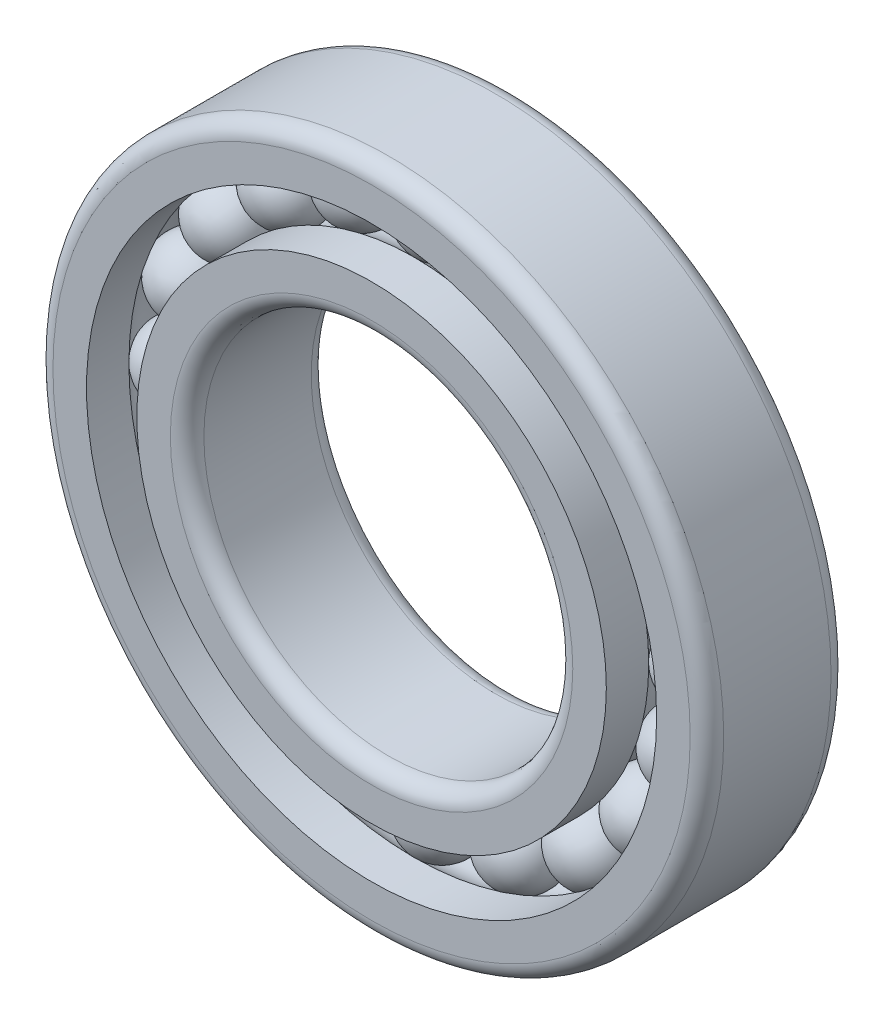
SolidWorks part; units mm, degrees
ref_plane "Front Plane" through (0, 0, 0) normal (0, 0, 1) x (1, 0, 0)
ref_plane "Top Plane" through (0, 0, 0) normal (0, 1, 0) x (1, 0, 0)
ref_plane "Right Plane" through (0, 0, 0) normal (1, 0, 0) x (0, 0, -1)
sketch "BaseSke" plane through (0, 0, 0) normal (1, 0, 0) x (0, 0, -1)
  line L0 (-47.2296, 0) -> (24.6132, 0) construction
  line L1 (-47.2296, 38.75) -> (24.6132, 38.75) construction
  line L2 (0, 129.5214) -> (0, -86.3012) construction
  line L3 (0, 44.375) -> (0, 33.125)
  line L4 (-10.5, 50) -> (10.5, 50) construction
  line L5 (-10.5, 27.5) -> (10.5, 27.5) construction
  arc A0 (0, 44.375) -> (0, 33.125) centre (0, 38.75) ccw
  dimension "Ball_diameter" = 11.25
  dimension "D1" = 38.75
  dimension "Bearing_Thickness" = 21
  dimension "Bearing_Outside_Diameter" = 100
  dimension "Bearing_Inside_Diameter" = 55
revolve "Ball" add sketch "BaseSke" angle 360 about L3
sketch "OuterRaceSke" plane through (0, 0, 0) normal (1, 0, 0) x (0, 0, -1)
  line L0 (0, 0) -> (0, 87.5396) construction
  line L1 (-10.5, 50) -> (10.5, 50)
  line L2 (-10.5, 50) -> (-10.5, 42.5)
  line L3 (-10.5, 42.5) -> (-4.1792, 42.5)
  line L4 (10.5, 50) -> (10.5, 42.5)
  line L5 (-50.3916, 0) -> (55.2197, 0) construction
  line L6 (-47.2296, 38.75) -> (24.6132, 38.75) construction
  line L7 (4.1792, 42.5) -> (10.5, 42.5)
  arc A0 (4.1792, 42.5) -> (-4.1792, 42.5) centre (0, 38.75) ccw
  dimension "D4" = 11.23
  dimension "D2" = 85
revolve "OuterRace" add sketch "OuterRaceSke" angle 360 about L5
sketch "InnerRaceSke" plane through (0, 0, 0) normal (1, 0, 0) x (0, 0, -1)
  line L0 (-70.8626, 0) -> (113.5527, 0) construction
  line L1 (0, 58.441) -> (0, -70.8113) construction
  line L2 (-10.5, 27.5) -> (10.5, 27.5)
  line L3 (-10.5, 27.5) -> (-10.5, 35)
  line L4 (-10.5, 35) -> (-4.1792, 35)
  line L5 (10.5, 27.5) -> (10.5, 35)
  line L6 (0, 129.5214) -> (0, -86.3012) construction
  line L7 (4.1792, 35) -> (10.5, 35)
  arc A0 (-4.1792, 35) -> (4.1792, 35) centre (0, 38.75) ccw
  arc A1 (0, 44.375) -> (0, 33.125) centre (0, 38.75) ccw construction
  dimension "D2" = 11.23
  dimension "D1" = 70
revolve "InnerRace" add sketch "InnerRaceSke" angle 360 about L0
fillet "Fillet1" radius 2.5 4 edges at (27.5, 0, -10.5) (27.5, 0, 10.5) (50, 0, -10.5) (50, 0, 10.5)
sketch "ShieldedSke" plane through (0, 0, 0) normal (1, 0, 0) x (0, 0, -1)
  line L1 (-9.25, 42.5) -> (-7, 42.5)
  line L2 (-10.5, 41.25) -> (-10.5, 36.25)
  line L3 (-9.25, 35) -> (-7, 35)
  line L4 (-7, 42.5) -> (-7, 35)
  arc A0 (-9.25, 42.5) -> (-10.5, 41.25) centre (-9.25, 41.25) ccw
  arc A1 (-10.5, 36.25) -> (-9.25, 35) centre (-9.25, 36.25) ccw
  point P12 (-10.5, 42.5)
  point P13 (-10.5, 35)
  dimension "D1" = 1.25
  dimension "D2" = 7
revolve "Shielded" [suppressed] add sketch "ShieldedSke" angle 360 about L0
mirror "DoubleShielded" [suppressed] about plane through (0, 0, 0) normal (0, 0, 1)
sketch "SealedSke" plane through (0, 0, 0) normal (1, 0, 0) x (0, 0, -1)
  line L0 (-34.5153, 0) -> (39.09, 0) construction
  line L1 (-28.4, 35) -> (-8.4, 35)
  line L2 (-28.4, 35) -> (-28.4, 42.5)
  line L3 (-28.4, 42.5) -> (-8.4, 42.5)
  line L4 (-8.4, 35) -> (-8.4, 42.5)
  dimension "D1" = 20
  dimension "D2" = 8.4
revolve "Sealed" [suppressed] cut sketch "SealedSke" angle 360 about L0
mirror "DoubleSealed" [suppressed] about plane through (0, 0, 0) normal (0, 0, 1)
pattern_circular "CirPatternBall" count 20 over 360 about axis through (0, 0, 0) along (0, 0, 1) of "Ball"
sketch "CutGrooveSke" plane through (0, 0, 0) normal (1, 0, 0) x (0, 0, -1)
  line L0 (-51.8407, 0) -> (83.8302, 0) construction
  line L1 (6.3, -69) -> (5.25, -69)
  line L2 (6.3, -69) -> (6.3, -49)
  line L3 (6.3, -49) -> (5.25, -49)
  line L4 (5.25, -69) -> (5.25, -49)
  dimension "D1" = 49
  dimension "D2" = 5.25
  dimension "D3" = 1.05
  dimension "D4" = 20
revolve "CutGroove" [suppressed] cut sketch "CutGrooveSke" angle 360 about L0
sketch "TaperSke" plane through (0, 0, 0) normal (1, 0, 0) x (0, 0, -1)
  line L0 (-10.5, 27.5) -> (10.5, 27.5)
  line L1 (10.5, 27.5) -> (10.5, 29.25)
  line L2 (10.5, 29.25) -> (-10.5, 27.5)
  line L7 (-41.2502, 0) -> (40.8606, 0) construction
  dimension "Taper" = 1.75
revolve "Taper" [suppressed] cut sketch "TaperSke" angle 360 about L7
fillet "Fillet2" [suppressed] radius 2.5
sketch "SimplifiedSke" plane through (0, 0, 0) normal (1, 0, 0) x (0, 0, -1)
  line L0 (37.5911, 0) -> (-37.5911, 0) construction
  circle A0 centre (0, 38.75) radius 5.625
  arc A1 (0, 44.375) -> (0, 33.125) centre (0, 38.75) ccw construction
revolve "Simplified" [suppressed] add sketch "SimplifiedSke" angle 360 about L0
equation "\"D1@BaseSke\" =  (\"Bearing_Outside_Diameter@BaseSke\"  +  \"Bearing_Inside_Diameter@BaseSke\"  )  / 4"
equation "\"Ball_diameter@BaseSke\" =  ( \"Bearing_Outside_Diameter@BaseSke\" - \"Bearing_Inside_Diameter@BaseSke\" ) / 4 "
equation "\"D2@OuterRaceSke\" = \"Bearing_Outside_Diameter@BaseSke\" -  ( \"Bearing_Outside_Diameter@BaseSke\" - \"Bearing_Inside_Diameter@BaseSke\" )  / 3"
equation "\"D4@OuterRaceSke\" = (  \"Bearing_Outside_Diameter@BaseSke\" - \"Bearing_Inside_Diameter@BaseSke\" ) / 4 -0.02"
equation "\"D1@InnerRaceSke\" = \"Bearing_Inside_Diameter@BaseSke\" +  ( \"Bearing_Outside_Diameter@BaseSke\" - \"Bearing_Inside_Diameter@BaseSke\" )  / 3"
equation "\"D2@InnerRaceSke\" = \"D4@OuterRaceSke\""
equation "\"D1@ShieldedSke\" = \"Fillet_radius@Fillet1\"/2"
equation "\"D2@ShieldedSke\" = \"Bearing_Thickness@BaseSke\"/3"
equation "\"D2@SealedSke\" = \"Bearing_Thickness@BaseSke\"/2.5"
equation "\"D1@CirPatternBall\" = int( \"D1@BaseSke\"* pi  * 2 / \"Ball_diameter@BaseSke\" ) -1"
equation "\"D1@CutGrooveSke\" = \"Bearing_Outside_Diameter@BaseSke\" * 0.49"
equation "\"D2@CutGrooveSke\" = \"Bearing_Thickness@BaseSke\" *0.25"
equation "\"D3@CutGrooveSke\" = \"Bearing_Thickness@BaseSke\"/20"
equation "\"Taper@TaperSke\" = \"Bearing_Thickness@BaseSke\"/12"
equation "\"D1@Fillet2\" = \"Fillet_radius@Fillet1\""
